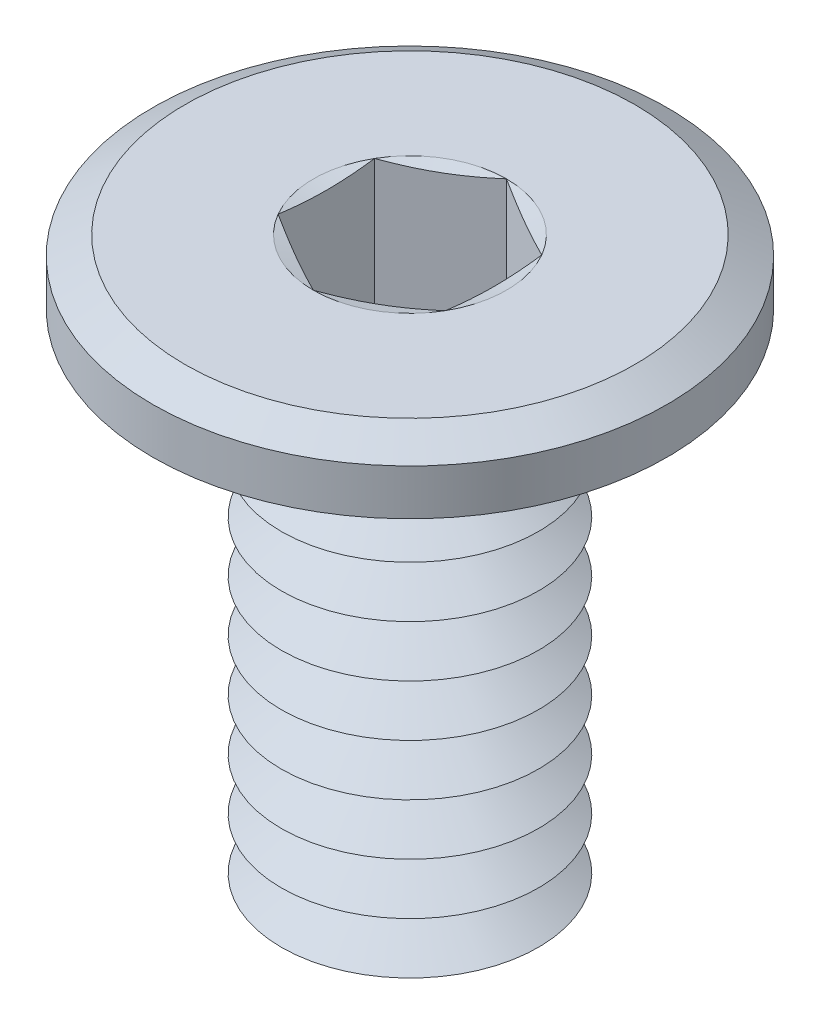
SolidWorks part; units mm, degrees
ref_plane "Front Plane" through (0, 0, 0) normal (0, 0, 1) x (1, 0, 0)
ref_plane "Top Plane" through (0, 0, 0) normal (0, 1, 0) x (1, 0, 0)
ref_plane "Right Plane" through (0, 0, 0) normal (1, 0, 0) x (0, 0, -1)
sketch "Sketch1" plane through (0, 0, 0) normal (0, 1, 0) x (1, 0, 0)
  circle A0 centre (0, 0) radius 2
  dimension "D1" = 4
extrude "Boss-Extrude1" add sketch "Sketch1" against normal blind 0.5
sketch "Sketch2" plane through (0, -0.5, 0) normal (0, -1, 0) x (1, 0, 0)
  circle A0 centre (0, 0) radius 1
  dimension "D1" = 2
extrude "Boss-Extrude2" add sketch "Sketch2" along normal blind 4
sketch "Sketch3" plane through (0, 0, 0) normal (1, 0, 0) x (0, 0, -1)
  line L0 (0, 0.9906) -> (0, -8.2999) construction
sketch "Sketch5" plane through (0, 0, 0) normal (1, 0, 0) x (0, 0, -1)
  line L0 (-1, -4.7) -> (-0.6536, -4.5)
  line L1 (-1, -0.5) -> (-1, -4.5) construction
  line L2 (-0.6536, -4.5) -> (-1, -4.3)
  line L3 (-1, -0.5) -> (-1, -4.5) construction
  line L4 (-1, -4.3) -> (-1, -4.7)
  line L6 (-1, -0.5) -> (-1, -4.5) construction
  line L7 (-1, -0.5) -> (-1, -4.5) construction
  line L14 (-1, -4.5) -> (1, -4.5) construction
  dimension "D1" = 0.4
revolve "Cut-Revolve1" cut sketch "Sketch5" angle 360 about L0
pattern_linear "LPattern1" count 9 spacing 0.4 along (0, 1, 0) of "Cut-Revolve1"
fillet "Fillet1" radius 0.1 1 edges at (0, -0.5, -1)
chamfer "Chamfer2" distance 0.25 angle 30 1 edges at (0, 0, 2)
sketch "Sketch6" plane through (0, 0, 0) normal (0, 1, 0) x (1, 0, 0)
  line L1 (0, 0.7506) -> (-0.65, 0.3753)
  line L2 (-0.65, 0.3753) -> (-0.65, -0.3753)
  line L3 (-0.65, -0.3753) -> (0, -0.7506)
  line L4 (0, -0.7506) -> (0.65, -0.3753)
  line L5 (0.65, -0.3753) -> (0.65, 0.3753)
  line L6 (0.65, 0.3753) -> (0, 0.7506)
  circle A0 centre (0, 0) radius 0.65 construction
  dimension "D1" = 1.3
extrude "Cut-Extrude1" cut sketch "Sketch6" against normal blind 1.2
sketch "Sketch7" plane through (0, -1.2, 0) normal (0, 1, 0) x (1, 0, 0)
  line L0 (-0.65, 0.3753) -> (-0.65, -0.3753) construction
  circle A0 centre (0, 0) radius 0.65
extrude "Cut-Extrude2" cut sketch "Sketch7" against normal through all draft 60
sketch "Sketch8" plane through (0, 0, 0) normal (0, 1, 0) x (1, 0, 0)
  circle A0 centre (0, 0) radius 0.7506
extrude "Cut-Extrude3" cut sketch "Sketch8" against normal through all draft 75
